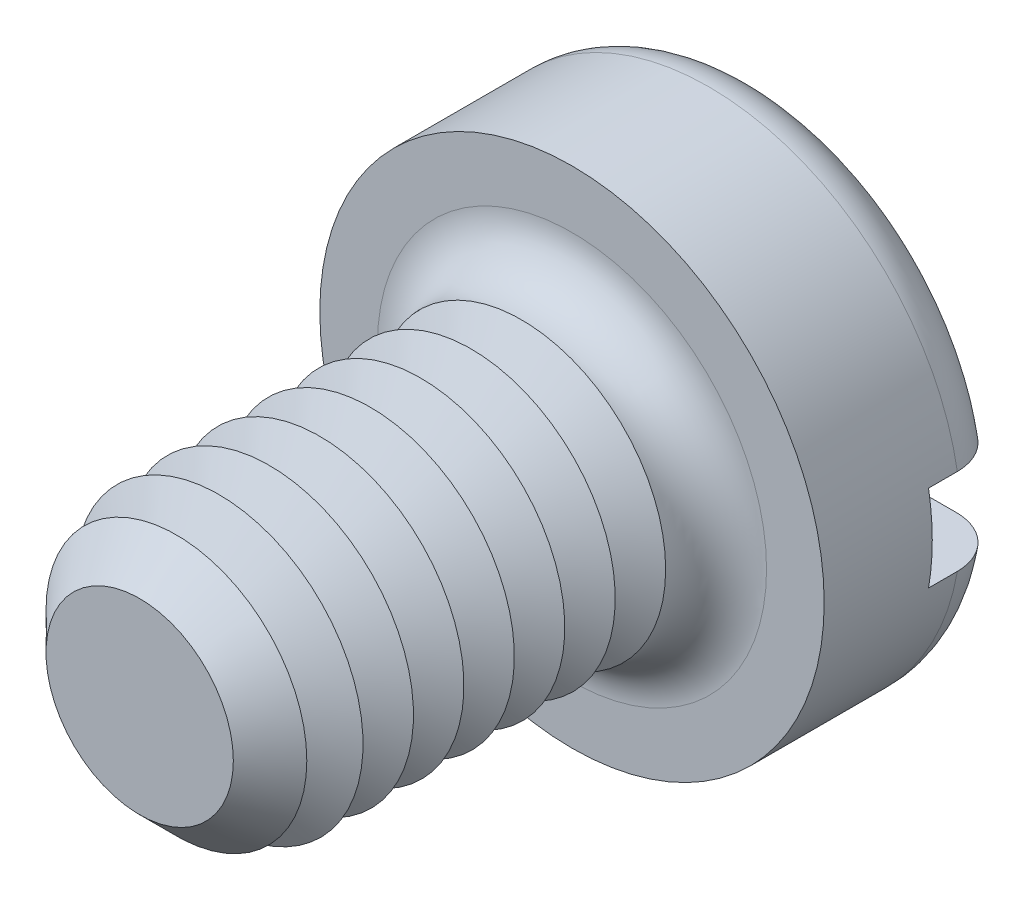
SolidWorks part; units mm, degrees
ref_plane "Front Plane" through (0, 0, 0) normal (0, 0, 1) x (1, 0, 0)
ref_plane "Top Plane" through (0, 0, 0) normal (0, 1, 0) x (1, 0, 0)
ref_plane "Right Plane" through (0, 0, 0) normal (1, 0, 0) x (0, 0, -1)
sketch "Sketch3" plane through (0, 0, 0) normal (0, 0, 1) x (1, 0, 0)
  circle A0 centre (0, 0) radius 3.5
  dimension "D1" = 7
extrude "Boss-Extrude2" add sketch "Sketch3" against normal blind 2.6
sketch "Sketch4" plane through (0, 0, 0) normal (0, 0, 1) x (1, 0, 0)
  circle A0 centre (0, 0) radius 2
  dimension "D1" = 4
extrude "Boss-Extrude3" add sketch "Sketch4" along normal blind 6
fillet "Fillet1" radius 0.7 2 edges at (3.5, 0, -2.6) (2, 0, 0)
chamfer "Chamfer1" distance 0.7 angle 45 1 edges at (2, 0, 6)
sketch "Sketch5" plane through (0, 0, 0) normal (1, 0, 0) x (0, 0, -1)
  line L0 (1.6944, 0) -> (-7.6738, 0) construction
sketch "Sketch6" plane through (0, 0, 0) normal (1, 0, 0) x (0, 0, -1)
  line L0 (-0.7, 2) -> (-1.05, 1.3938)
  line L1 (-1.05, 1.3938) -> (-1.4, 2)
  line L2 (-0.7, 2) -> (-5.3, 2) construction
  line L3 (-1.4, 2) -> (-0.7, 2)
  dimension "D1" = 0.7
revolve "Cut-Revolve1" cut sketch "Sketch6" angle 360 about L0
pattern_linear "LPattern1" count 8 spacing 0.7 along (0, 0, 1) of "Cut-Revolve1"
sketch "Sketch8" plane through (0, 0, -2.6) normal (0, 0, -1) x (-1, 0, 0)
  line L1 (3.5, -0.6) -> (-3.5, -0.6)
  line L2 (3.5, -0.6) -> (3.5, 0.6)
  line L3 (3.5, 0.6) -> (-3.5, 0.6)
  line L4 (-3.5, -0.6) -> (-3.5, 0.6)
  line L5 (3.5, -0.6) -> (-3.5, 0.6) construction
  line L6 (3.5, 0.6) -> (-3.5, -0.6) construction
  point P0 (0, 0)
  dimension "D1" = 7
  dimension "D2" = 1.2
extrude "Cut-Extrude1" cut sketch "Sketch8" against normal blind 1.1
